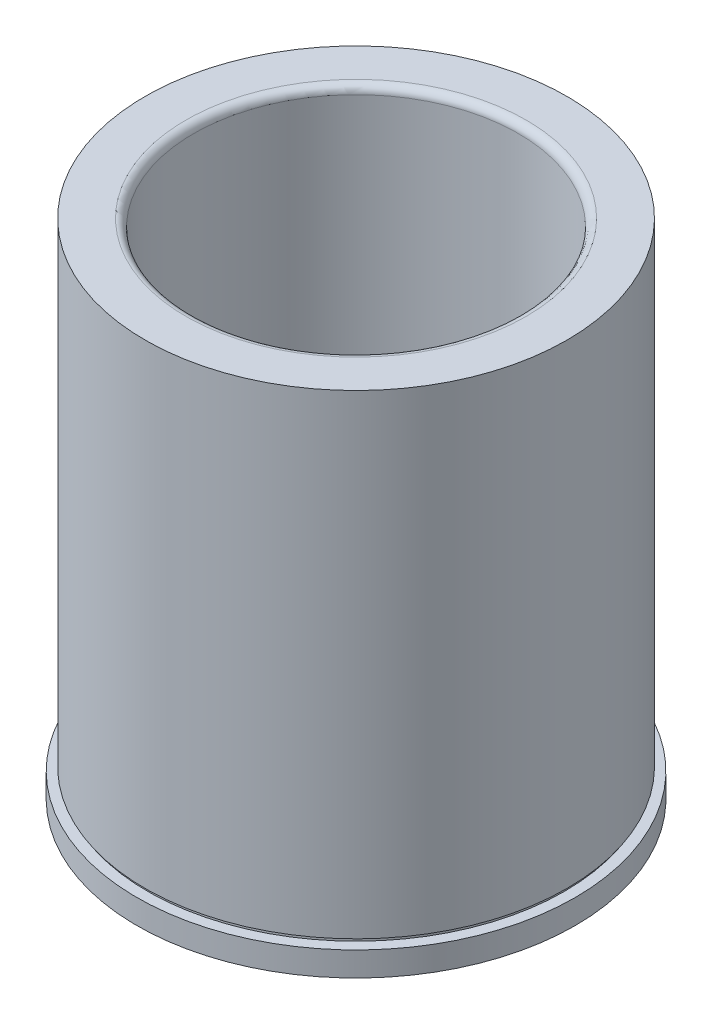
SolidWorks part; units mm, degrees
ref_plane "Front Plane" through (0, 0, 0) normal (0, 0, 1) x (1, 0, 0)
ref_plane "Top Plane" through (0, 0, 0) normal (0, 1, 0) x (1, 0, 0)
ref_plane "Right Plane" through (0, 0, 0) normal (1, 0, 0) x (0, 0, -1)
sketch "Sketch1" plane through (0, 0, 0) normal (0, 0, 1) x (1, 0, 0)
  line L0 (-954.952, 354.8153) -> (45914.4077, -17059.6364) construction
  line L1 (0, -1000) -> (0, 49000) construction
  line L2 (-31.7564, 114.3507) -> (-31.7563, 16.7417)
  line L3 (-32.5724, 15.9257) -> (-42.8625, 15.9257)
  line L4 (-42.8625, 15.9257) -> (-42.8625, 20.6882)
  line L5 (-42.8625, 20.6882) -> (-40.7733, 20.6882)
  line L6 (-41.2814, 114.3507) -> (-41.2813, 21.4502)
  line L7 (-41.2814, 114.3507) -> (-31.7564, 114.3507)
  line L8 (-32.5724, 15.9257) -> (-31.7563, 16.7417)
  line L10 (-41.2813, 21.4502) -> (-40.7733, 21.4502)
  line L11 (-40.7733, 21.4502) -> (-40.7733, 20.6882)
  dimension "D1" = 0.508
  dimension "OD" = 82.5627
  dimension "ID" = 63.5127
  dimension "FLANGETHICKNESS" = 4.7625
  dimension "FLANGEDIA" = 85.725
  dimension "D2" = 45
  dimension "D3" = 0.762
  dimension "OVERALL LENGTH" = 98.425
revolve "Revolve1" add sketch "Sketch1" angle 360 about L1
fillet "Fillet1" radius 1.524 1 edges at (31.7563, 114.3507, 0)
